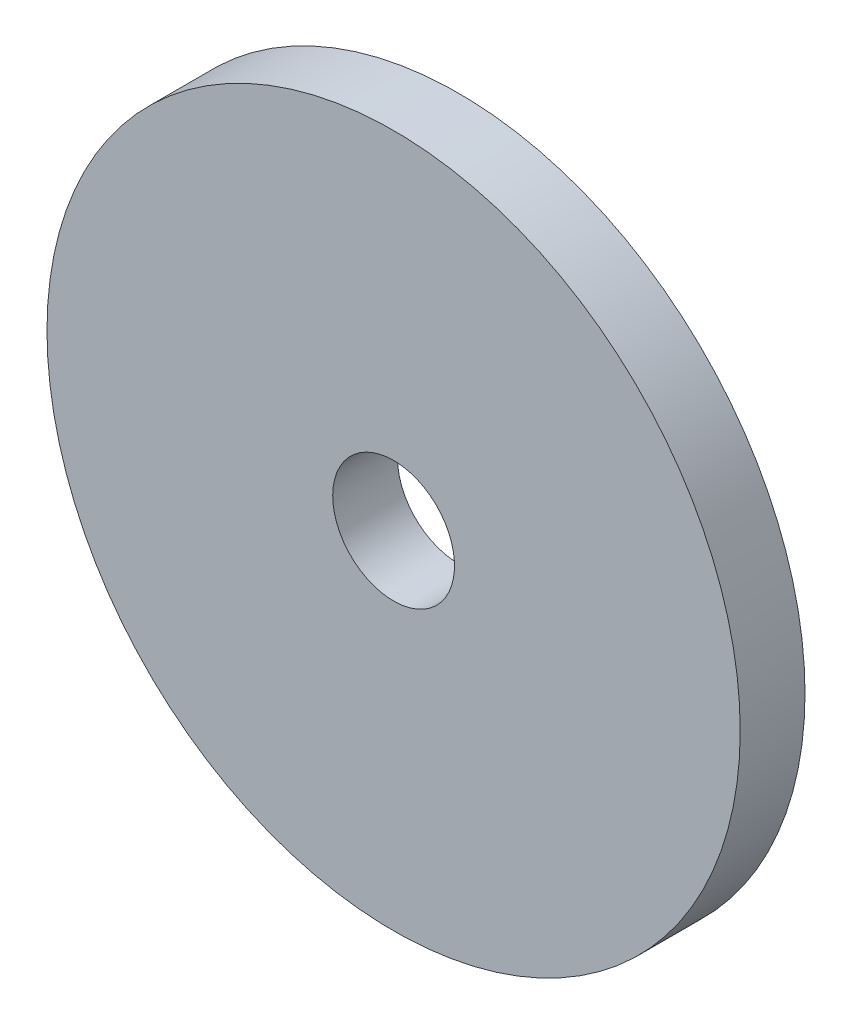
SolidWorks part; units mm, degrees
ref_plane "Front" through (0, 0, 0) normal (0, 0, 1) x (1, 0, 0)
ref_plane "Top" through (0, 0, 0) normal (0, 1, 0) x (1, 0, 0)
ref_plane "Right" through (0, 0, 0) normal (1, 0, 0) x (0, 0, -1)
sketch "Sketch1" plane through (0, 0, 0) normal (0, 0, 1) x (1, 0, 0)
  circle A0 centre (0, 0) radius 2.3876
  circle A1 centre (0, 0) radius 13.589
  dimension "D1" = 4.7752
  dimension "D2" = 27.178
extrude "Extrude1" add sketch "Sketch1" along normal blind 2.54
